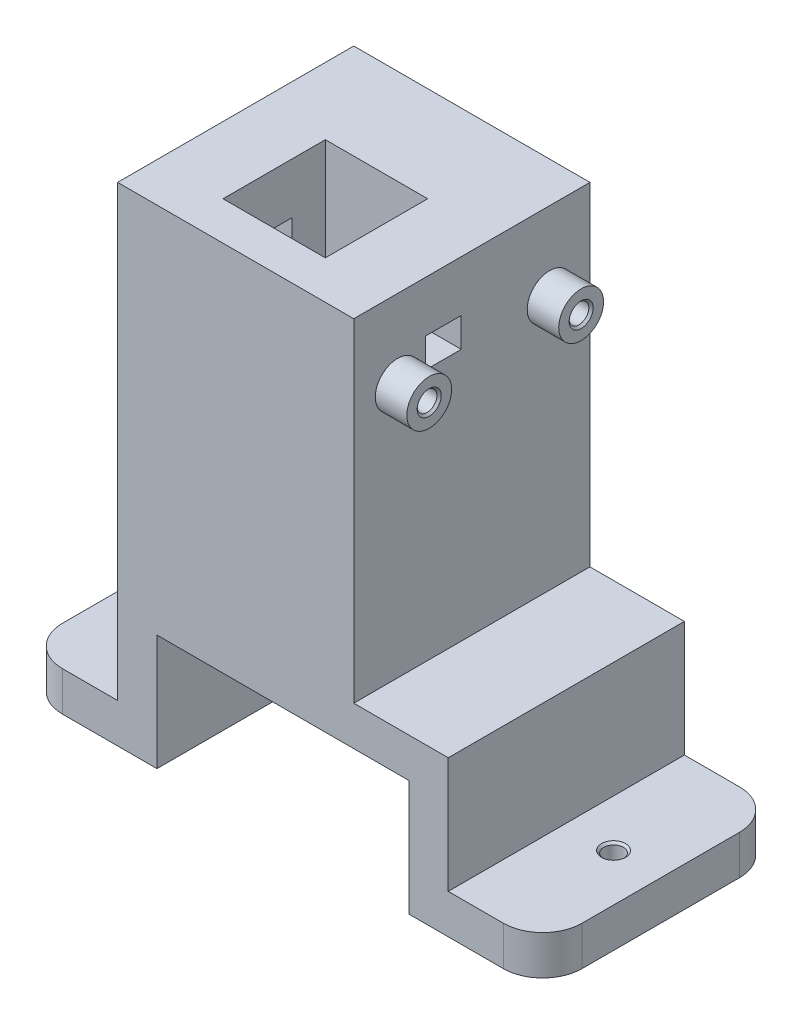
SolidWorks part; units mm, degrees
ref_plane "前视基准面" through (0, 0, 0) normal (0, 0, 1) x (1, 0, 0)
ref_plane "上视基准面" through (0, 0, 0) normal (0, 1, 0) x (1, 0, 0)
ref_plane "右视基准面" through (0, 0, 0) normal (1, 0, 0) x (0, 0, -1)
other "Configuration Table"
sketch "草图1" plane through (0, 0, 0) normal (0, 0, 1) x (1, 0, 0)
  line L1 (-17.5353, 24.5629) -> (12.4647, 24.5629)
  line L4 (12.4647, 24.5629) -> (12.4647, -17.7371)
  line L5 (-17.5353, 24.5629) -> (-17.5353, -32.4371)
  line L6 (-17.5353, -32.4371) -> (-29.5353, -32.4371)
  line L11 (24.4647, -17.7371) -> (12.4647, -17.7371)
  line L17 (19.4647, -37.4371) -> (19.4647, -22.7371)
  line L18 (-29.5353, -32.4371) -> (-29.5353, -37.4371)
  line L19 (-29.5353, -37.4371) -> (-12.5353, -37.4371)
  line L20 (-12.5353, -37.4371) -> (-12.5353, -22.7371)
  line L21 (-12.5353, -22.7371) -> (19.4647, -22.7371)
  line L22 (24.4647, -17.7371) -> (24.4647, -32.4371)
  line L23 (24.4647, -32.4371) -> (36.4647, -32.4371)
  line L24 (36.4647, -32.4371) -> (36.4647, -37.4371)
  line L26 (19.4647, -37.4371) -> (36.4647, -37.4371)
  point P0 (0, 0)
  point P1 (12.4647, 3.4129)
  dimension "D1" = 5
  dimension "D2" = 40.85
  dimension "D3" = 5
  dimension "D4" = 30
  dimension "D5" = 5
  dimension "D6" = 5
  dimension "D7" = 5
  dimension "D8" = 62
  dimension "D9" = 12
  dimension "D10" = 12
  dimension "D11" = 12
extrude "凸台-拉伸1" add sketch "草图1" along normal blind 30
sketch "草图2" plane through (12.4647, 0, 0) normal (1, 0, 0) x (0, 0, -1)
  line L0 (-14.7671, 26.961) -> (-14.7671, -26.0349) construction
  line L3 (-30, -37.4371) -> (0, -37.4371) construction
  circle A0 centre (-24.4171, 14.5629) radius 2.85
  circle A1 centre (-5.1171, 14.5629) radius 2.85
  dimension "D1" = 5.7
  dimension "D2" = 19.3
  dimension "D3" = 52
extrude "凸台-拉伸2" add sketch "草图2" along normal blind 4
sketch "草图3" plane through (12.4647, 0, 0) normal (1, 0, 0) x (0, 0, -1)
  line L0 (-15, 27.3569) -> (-15, -24.9037) construction
  line L2 (-20.8724, 18.0993) -> (-16.3476, 18.0993)
  line L3 (-20.8724, 18.0993) -> (-20.8724, 14.3664)
  line L4 (-20.8724, 14.3664) -> (-16.3476, 14.3664)
  line L5 (-16.3476, 18.0993) -> (-16.3476, 14.3664)
  line L6 (-20.8724, 18.0993) -> (-16.3476, 14.3664) construction
  line L7 (-20.8724, 14.3664) -> (-16.3476, 18.0993) construction
  circle A0 centre (-24.4171, 14.5629) radius 2.85 construction
  circle A1 centre (-24.4171, 14.5629) radius 2.85
  point P2 (-18.61, 16.2329)
  dimension "D1" = 1.67
  dimension "D2" = 3.61
sketch "草图4" plane through (0, 24.5629, 0) normal (0, 1, 0) x (1, 0, 0)
  line L0 (-2.5353, 4.1913) -> (-2.5353, -34.3774) construction
  line L2 (-9.0353, -12.11) -> (3.9647, -12.11)
  line L3 (-9.0353, -12.11) -> (-9.0353, -25.11)
  line L4 (-9.0353, -25.11) -> (3.9647, -25.11)
  line L5 (3.9647, -12.11) -> (3.9647, -25.11)
  line L6 (-9.0353, -12.11) -> (3.9647, -25.11) construction
  line L7 (-9.0353, -25.11) -> (3.9647, -12.11) construction
  point P0 (-2.5353, -18.61)
  dimension "D1" = 13
extrude "切除-拉伸1" cut sketch "草图4" against normal blind 30
extrude "切除-拉伸2" cut sketch "草图3" against normal blind 63 contours L2 L5 L4 L3
sketch "草图6" plane through (0, -32.4371, 0) normal (0, 1, 0) x (1, 0, 0)
  line L0 (-17.5353, 0) -> (-29.5353, 0) construction
  point P0 (-23.5353, -15)
  point P1 (30.4647, -15)
  point P6 (-23.5353, 0)
hole_wizard "M3 螺纹孔1" positions "草图6" profile "草图7" tap size "M3" standard "GB"
sketch "草图7" plane through (-23.5353, -32.4371, 15) normal (1, 0, 0) x (0, 0, 1)
  line L0 (0, 0) -> (0, 5)
  line L1 (0, 5) -> (1.25, 5)
  line L2 (1.25, 5) -> (1.25, 0.275)
  line L3 (1.25, 0.275) -> (1.525, 0)
  line L5 (1.525, 0) -> (0, 0)
  line L6 (-1.25, 0.275) -> (-1.525, 0) construction
  line L11 (0, -6.35) -> (0, 107.95) construction
  dimension "通孔螺纹孔钻头直径" = 2.5
  dimension "通孔螺纹孔钻头深度" = 5
  dimension "近端锥形沉头孔直径" = 3.05
  dimension "近端锥形沉头孔角度" = 90
sketch "草图8" plane through (16.4647, 0, 0) normal (1, 0, 0) x (0, 0, -1)
  point P0 (-24.4171, 14.5629)
  point P1 (-5.1171, 14.5629)
hole_wizard "M3 螺纹孔2" positions "草图8" profile "草图9" tap size "M3" standard "GB"
sketch "草图9" plane through (16.4647, 14.5629, 24.4171) normal (0, 1, 0) x (0, 0, -1)
  line L0 (0, 0) -> (0, 12.3511)
  line L1 (0, 12.3511) -> (1.25, 11.6)
  line L2 (1.25, 11.6) -> (1.25, 0.275)
  line L3 (1.25, 0.275) -> (1.525, 0)
  line L5 (1.525, 0) -> (0, 0)
  line L6 (-1.25, 0.275) -> (-1.525, 0) construction
  line L10 (0, 12.3511) -> (-1.25, 11.6) construction
  line L11 (0, -6.35) -> (0, 107.95) construction
  dimension "螺纹孔钻头直径" = 2.5
  dimension "螺纹孔钻头深度" = 11.6
  dimension "近端锥形沉头孔直径" = 3.05
  dimension "近端锥形沉头孔角度" = 90
  dimension "导头角度" = 118
fillet "圆角2" radius 5 4 edges at (36.4647, -34.9371, 0) (36.4647, -34.9371, 30) (-29.5353, -34.9371, 30) (-29.5353, -34.9371, 0)
ref_plane "基准面1" through (12.4647, 18.0993, 16.3476) normal (0, 0, -1) x (-1, 0, 0)
sketch "草图10" plane through (12.4647, 0, 0) normal (1, 0, 0) x (0, 0, -1)
  line L8 (-25, -37.4371) -> (-5, -37.4371) construction
  point P4 (-20.8724, 16.2329)
  dimension "D1" = 53.67
